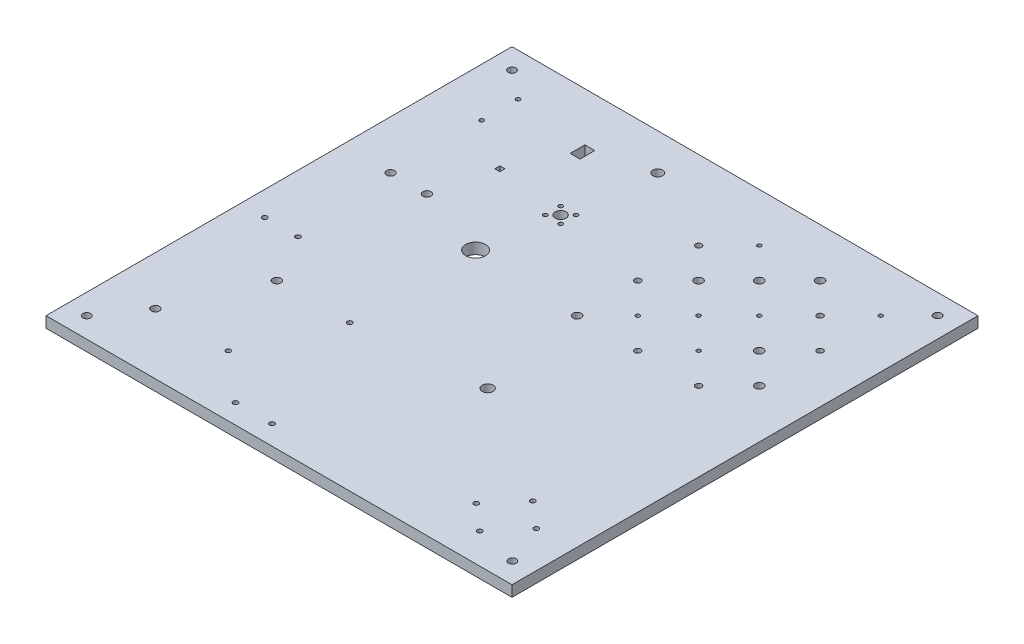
SolidWorks part; units mm, degrees
ref_plane "Front Plane" through (0, 0, 0) normal (0, 0, 1) x (1, 0, 0)
ref_plane "Top Plane" through (0, 0, 0) normal (0, 1, 0) x (1, 0, 0)
ref_plane "Right Plane" through (0, 0, 0) normal (1, 0, 0) x (0, 0, -1)
sketch "Sketch2" plane through (0, 0, 0) normal (0, 1, 0) x (1, 0, 0)
  line L1 (-191.77, -191.77) -> (191.77, -191.77)
  line L2 (-191.77, -191.77) -> (-191.77, 191.77)
  line L3 (-191.77, 191.77) -> (191.77, 191.77)
  line L4 (191.77, -191.77) -> (191.77, 191.77)
  line L5 (-191.77, -191.77) -> (191.77, 191.77) construction
  line L6 (-191.77, 191.77) -> (191.77, -191.77) construction
  point P0 (0, 0)
  dimension "D1" = 383.54
  dimension "D2" = 383.54
extrude "Boss-Extrude2" add sketch "Sketch2" along normal blind 8.9916
hole_wizard "Tap Drill for M4x0.7 Tap1" positions "Sketch3" profile "Sketch4" hole size "M4x0.7" standard "ANSI Metric"
sketch "Sketch3" plane through (0, 8.9916, 0) normal (0, 1, 0) x (1, 0, 0)
  line L0 (191.77, 191.77) -> (-191.77, 191.77) construction
  line L1 (191.77, -191.77) -> (191.77, 191.77) construction
  point P0 (51.77, 151.77)
  point P2 (151.77, 151.77)
  point P4 (101.77, 101.77)
  point P6 (51.77, 51.77)
  point P8 (76.77, 76.77)
  point P10 (101.77, 51.77)
  dimension "D1" = 40
  dimension "D2" = 40
  dimension "D3" = 40
  dimension "D4" = 100
  dimension "D5" = 50
  dimension "D6" = 50
  dimension "D7" = 50
  dimension "D8" = 50
  dimension "D9" = 50
  dimension "D10" = 25
  dimension "D11" = 25
  dimension "D12" = 90
sketch "Sketch4" plane through (51.77, 8.9916, -151.77) normal (1, 0, 0) x (0, 0, 1)
  line L0 (0, 0) -> (0, 8.9916)
  line L1 (0, 8.9916) -> (1.65, 8.9916)
  line L2 (1.65, 8.9916) -> (1.65, 0)
  line L5 (1.65, 0) -> (0, 0)
  line L11 (0, -6.35) -> (0, 107.95) construction
  dimension "Thru Hole Dia." = 3.3
  dimension "Thru Hole Depth" = 8.9916
hole_wizard "Tap Drill for M6x1.0 Tap1" positions "Sketch5" profile "Sketch6" hole size "M6x1.0" standard "ANSI Metric"
sketch "Sketch5" plane through (0, 8.9916, 0) normal (0, 1, 0) x (1, 0, 0)
  line L0 (191.77, 191.77) -> (-191.77, 191.77) construction
  line L1 (191.77, -191.77) -> (191.77, 191.77) construction
  circle A0 centre (101.77, 51.77) radius 1.65 construction
  point P0 (126.77, 126.77)
  point P2 (26.77, 126.77)
  point P4 (151.77, 101.77)
  point P6 (126.77, 26.77)
  point P8 (76.77, 26.77)
  point P10 (26.77, 76.77)
  point P27 (176.1878, 220.1777)
  dimension "D1" = 65
  dimension "D2" = 65
  dimension "D3" = 165
  dimension "D4" = 65
  dimension "D5" = 40
  dimension "D6" = 90
  dimension "D7" = 25
  dimension "D8" = 25
  dimension "D9" = 50
  dimension "D10" = 65
  dimension "D11" = 50
  dimension "D12" = 165
sketch "Sketch6" plane through (126.77, 8.9916, -126.77) normal (1, 0, 0) x (0, 0, 1)
  line L0 (0, 0) -> (0, 8.9916)
  line L1 (0, 8.9916) -> (2.5, 8.9916)
  line L2 (2.5, 8.9916) -> (2.5, 0)
  line L5 (2.5, 0) -> (0, 0)
  line L11 (0, -6.35) -> (0, 107.95) construction
  dimension "Thru Hole Dia." = 5
  dimension "Thru Hole Depth" = 8.9916
hole_wizard "Tap Drill for M8x1.25 Tap1" positions "Sketch7" profile "Sketch8" hole size "M8x1.25" standard "ANSI Metric"
sketch "Sketch7" plane through (0, 8.9916, 0) normal (0, 1, 0) x (1, 0, 0)
  line L0 (191.77, 191.77) -> (-191.77, 191.77) construction
  line L1 (191.77, -191.77) -> (191.77, 191.77) construction
  circle A0 centre (151.77, 151.77) radius 1.65 construction
  point P0 (151.77, 51.77)
  point P2 (126.77, 76.77)
  point P4 (76.77, 126.77)
  point P6 (101.77, 151.77)
  point P8 (26.77, 26.77)
  point P10 (51.77, 101.77)
  dimension "D1" = 40
  dimension "D2" = 50
  dimension "D3" = 25
  dimension "D4" = 25
  dimension "D5" = 90
  dimension "D6" = 140
  dimension "D7" = 25
  dimension "D8" = 65
  dimension "D9" = 40
  dimension "D10" = 140
  dimension "D11" = 25
  dimension "D12" = 165
sketch "Sketch8" plane through (151.77, 8.9916, -51.77) normal (1, 0, 0) x (0, 0, 1)
  line L0 (0, 0) -> (0, 8.9916)
  line L1 (0, 8.9916) -> (3.4, 8.9916)
  line L2 (3.4, 8.9916) -> (3.4, 0)
  line L5 (3.4, 0) -> (0, 0)
  line L11 (0, -6.35) -> (0, 107.95) construction
  dimension "Thru Hole Dia." = 6.8
  dimension "Thru Hole Depth" = 8.9916
hole_wizard "1/4 (0.2500) Dowel Hole1" positions "Sketch9" profile "Sketch10" hole size "1/4" standard "ANSI Inch"
sketch "Sketch9" plane through (0, 8.9916, 0) normal (0, 1, 0) x (1, 0, 0)
  line L1 (-191.77, -191.77) -> (191.77, -191.77) construction
  line L10 (191.77, -191.77) -> (191.77, 191.77) construction
  line L11 (191.77, 191.77) -> (-191.77, 191.77) construction
  point P0 (-175, -175)
  point P2 (-175, 175)
  point P4 (175, 175.23)
  point P6 (175, -174.77)
  dimension "D1" = 350
  dimension "D2" = 350
  dimension "D3" = 350
  dimension "D4" = 350
  dimension "D5" = 16.77
  dimension "D6" = 16.77
  dimension "D7" = 16.77
sketch "Sketch10" plane through (-175, 8.9916, 175) normal (1, 0, 0) x (0, 0, 1)
  line L0 (0, 0) -> (0, 8.9916)
  line L1 (0, 8.9916) -> (3.175, 8.9916)
  line L2 (3.175, 8.9916) -> (3.175, 0)
  line L5 (3.175, 0) -> (0, 0)
  line L11 (0, -6.35) -> (0, 107.95) construction
  dimension "Thru Hole Dia." = 6.35
  dimension "Thru Hole Depth" = 8.9916
hole_wizard "Ø4.0mm Dowel Hole1" positions "Sketch11" profile "Sketch12" hole size "Ø4.0" standard "ANSI Metric"
sketch "Sketch11" plane through (0, 8.9916, 0) normal (0, 1, 0) x (1, 0, 0)
  line L0 (-191.77, -191.77) -> (191.77, -191.77) construction
  line L1 (-191.77, 191.77) -> (-191.77, -191.77) construction
  line L2 (191.77, -191.77) -> (191.77, 191.77) construction
  point P0 (-51.77, -175.77)
  point P2 (-21.77, -175.77)
  point P4 (-91.77, -141.77)
  point P6 (-61.77, -71.77)
  point P24 (-171.77, -31.77)
  point P26 (-144.338, -31.77)
  point P71 (140.2293, -166.77)
  point P72 (161.77, -141.77)
  point P73 (140.5778, -123.47)
  point P74 (119.0371, -148.47)
  dimension "D1" = 30
  dimension "D2" = 16
  dimension "D3" = 50
  dimension "D4" = 100
  dimension "D5" = 130
  dimension "D6" = 120
  dimension "D7" = 27.432
  dimension "D8" = 20
  dimension "D9" = 160
  dimension "D10" = 33
  dimension "D11" = 50
  dimension "D12" = 68.3
  dimension "D13" = 33
  dimension "D14" = 28
  dimension "D15" = 28
  dimension "D16" = 30
  dimension "D17" = 25
  dimension "D18" = 140
sketch "Sketch12" plane through (-51.77, 8.9916, 175.77) normal (1, 0, 0) x (0, 0, 1)
  line L0 (0, 0) -> (0, 10.1917)
  line L1 (0, 10.1917) -> (2, 8.99)
  line L2 (2, 8.99) -> (2, 0)
  line L5 (2, 0) -> (0, 0)
  line L10 (0, 10.1917) -> (-2, 8.99) construction
  line L11 (0, -6.35) -> (0, 107.95) construction
  dimension "Hole Dia." = 4
  dimension "Hole Depth" = 8.99
  dimension "Drill Angle" = 118
hole_wizard "M6 Clearance Hole2" positions "Sketch13" profile "Sketch14" hole size "M6" standard "ANSI Metric"
sketch "Sketch13" plane through (0, 8.9916, 0) normal (0, 1, 0) x (1, 0, 0)
  line L0 (-191.77, 191.77) -> (-191.77, -191.77) construction
  line L1 (191.77, 191.77) -> (-191.77, 191.77) construction
  line L2 (-191.77, -191.77) -> (191.77, -191.77) construction
  circle A2 centre (-61.77, -71.77) radius 2 construction
  circle A3 centre (-91.77, -141.77) radius 2 construction
  point P0 (-151.77, -141.77)
  point P2 (-121.77, -71.77)
  point P4 (-151.77, 51.77)
  point P6 (-121.77, 51.77)
  dimension "D5" = 60
  dimension "D1" = 30
  dimension "D2" = 40
  dimension "D3" = 140
  dimension "D4" = 60
  dimension "D6" = 120
  dimension "D7" = 50
sketch "Sketch14" plane through (-151.77, 8.9916, 141.77) normal (1, 0, 0) x (0, 0, 1)
  line L0 (0, 0) -> (0, 10.9728)
  line L1 (0, 10.9728) -> (3.3, 8.99)
  line L2 (3.3, 8.99) -> (3.3, 0)
  line L5 (3.3, 0) -> (0, 0)
  line L10 (0, 10.9728) -> (-3.3, 8.99) construction
  line L11 (0, -6.35) -> (0, 107.95) construction
  dimension "Hole Dia." = 6.6
  dimension "Hole Depth" = 8.99
  dimension "Drill Angle" = 118
hole_wizard "M8 Clearance Hole1" positions "Sketch15" profile "Sketch16" hole size "M8" standard "ANSI Metric"
sketch "Sketch15" plane through (0, 8.9916, 0) normal (0, 1, 0) x (1, 0, 0)
  line L0 (191.77, -191.77) -> (191.77, 191.77) construction
  line L1 (-191.77, -191.77) -> (191.77, -191.77) construction
  point P0 (41.77, -61.77)
  dimension "D1" = 150
  dimension "D2" = 130
sketch "Sketch16" plane through (41.77, 8.9916, 61.77) normal (1, 0, 0) x (0, 0, 1)
  line L0 (0, 0) -> (0, 11.6939)
  line L1 (0, 11.6939) -> (4.5, 8.99)
  line L2 (4.5, 8.99) -> (4.5, 0)
  line L5 (4.5, 0) -> (0, 0)
  line L10 (0, 11.6939) -> (-4.5, 8.99) construction
  line L11 (0, -6.35) -> (0, 107.95) construction
  dimension "Hole Dia." = 9
  dimension "Hole Depth" = 8.99
  dimension "Drill Angle" = 118
hole_wizard "M3 Clearance Hole1" positions "Sketch17" profile "Sketch18" hole size "M3" standard "ANSI Metric"
sketch "Sketch17" plane through (0, 8.9916, 0) normal (0, 1, 0) x (1, 0, 0)
  line L0 (-191.77, 191.77) -> (-191.77, -191.77) construction
  line L1 (191.77, 191.77) -> (-191.77, 191.77) construction
  point P0 (-151.77, 156.77)
  point P2 (-151.77, 126.77)
  point P4 (-58.09, 85.44)
  point P6 (-45.44, 85.44)
  point P8 (-45.44, 98.09)
  point P10 (-58.09, 98.09)
  dimension "D1" = 30
  dimension "D2" = 12.65
  dimension "D3" = 12.65
  dimension "D4" = 12.65
  dimension "D5" = 12.65
  dimension "D6" = 17.8898
  dimension "D7" = 40
  dimension "D8" = 35
  dimension "D9" = 40
  dimension "D10" = 133.68
  dimension "D11" = 93.68
sketch "Sketch18" plane through (-151.77, 8.9916, -156.77) normal (1, 0, 0) x (0, 0, 1)
  line L0 (0, 0) -> (0, 10.0115)
  line L1 (0, 10.0115) -> (1.7, 8.99)
  line L2 (1.7, 8.99) -> (1.7, 0)
  line L5 (1.7, 0) -> (0, 0)
  line L10 (0, 10.0115) -> (-1.7, 8.99) construction
  line L11 (0, -6.35) -> (0, 107.95) construction
  dimension "Hole Dia." = 3.4
  dimension "Hole Depth" = 8.99
  dimension "Drill Angle" = 118
sketch "Sketch19" plane through (0, 8.9916, 0) normal (0, 1, 0) x (1, 0, 0)
  line L0 (-91.77, 151.77) -> (-91.77, 139.63)
  line L1 (-91.77, 139.63) -> (-83.65, 139.63)
  line L2 (-83.65, 139.63) -> (-83.65, 151.77)
  line L3 (-83.65, 151.77) -> (-91.77, 151.77)
  line L4 (-111.77, 101.77) -> (-111.77, 97.65)
  line L5 (-111.77, 97.65) -> (-107.65, 97.65)
  line L6 (-107.65, 97.65) -> (-107.65, 101.77)
  line L7 (-107.65, 101.77) -> (-111.77, 101.77)
  line L8 (191.77, 191.77) -> (-191.77, 191.77) construction
  line L9 (-191.77, 191.77) -> (-191.77, -191.77) construction
  circle A0 centre (-61.77, 31.77) radius 8.1
  circle A1 centre (-41.77, 161.77) radius 4.06
  circle A2 centre (-51.77, 91.77) radius 4.5
  dimension "D1" = 4.12
  dimension "D13" = 100
  dimension "D2" = 4.12
  dimension "D3" = 8.12
  dimension "D4" = 12.14
  dimension "D5" = 40
  dimension "D6" = 100
  dimension "D7" = 90
  dimension "D8" = 80
  dimension "D9" = 130
  dimension "D10" = 160
  dimension "D11" = 30
  dimension "D12" = 150
  dimension "D14" = 140
extrude "Cut-Extrude1" cut sketch "Sketch19" against normal through all
